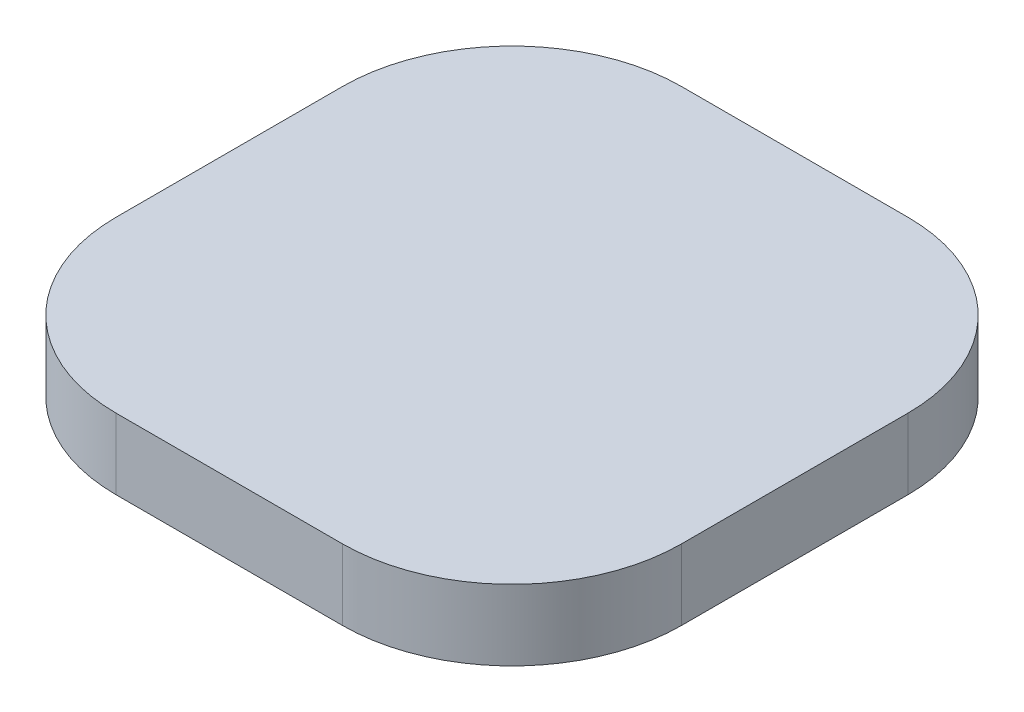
SolidWorks part; units mm, degrees
ref_plane "Front Plane" through (0, 0, 0) normal (0, 0, 1) x (1, 0, 0)
ref_plane "Top Plane" through (0, 0, 0) normal (0, 1, 0) x (1, 0, 0)
ref_plane "Right Plane" through (0, 0, 0) normal (1, 0, 0) x (0, 0, -1)
sketch "Sketch1" plane through (0, 0, 0) normal (0, 1, 0) x (1, 0, 0)
  line L1 (15.24, 0) -> (35.56, 0)
  line L2 (0, 15.24) -> (0, 35.56)
  line L3 (15.24, 50.8) -> (35.56, 50.8)
  line L4 (50.8, 15.24) -> (50.8, 35.56)
  arc A0 (15.24, 0) -> (0, 15.24) centre (15.24, 15.24) cw
  arc A1 (35.56, 0) -> (50.8, 15.24) centre (35.56, 15.24) ccw
  arc A2 (35.56, 50.8) -> (50.8, 35.56) centre (35.56, 35.56) cw
  arc A3 (0, 35.56) -> (15.24, 50.8) centre (15.24, 35.56) cw
  point P7 (0, 0)
  point P12 (50.8, 50.8)
  point P15 (0, 50.8)
  dimension "D3" = 15.24
  dimension "D1" = 50.8
  dimension "D2" = 50.8
extrude "Boss-Extrude1" add sketch "Sketch1" along normal blind 6.35
